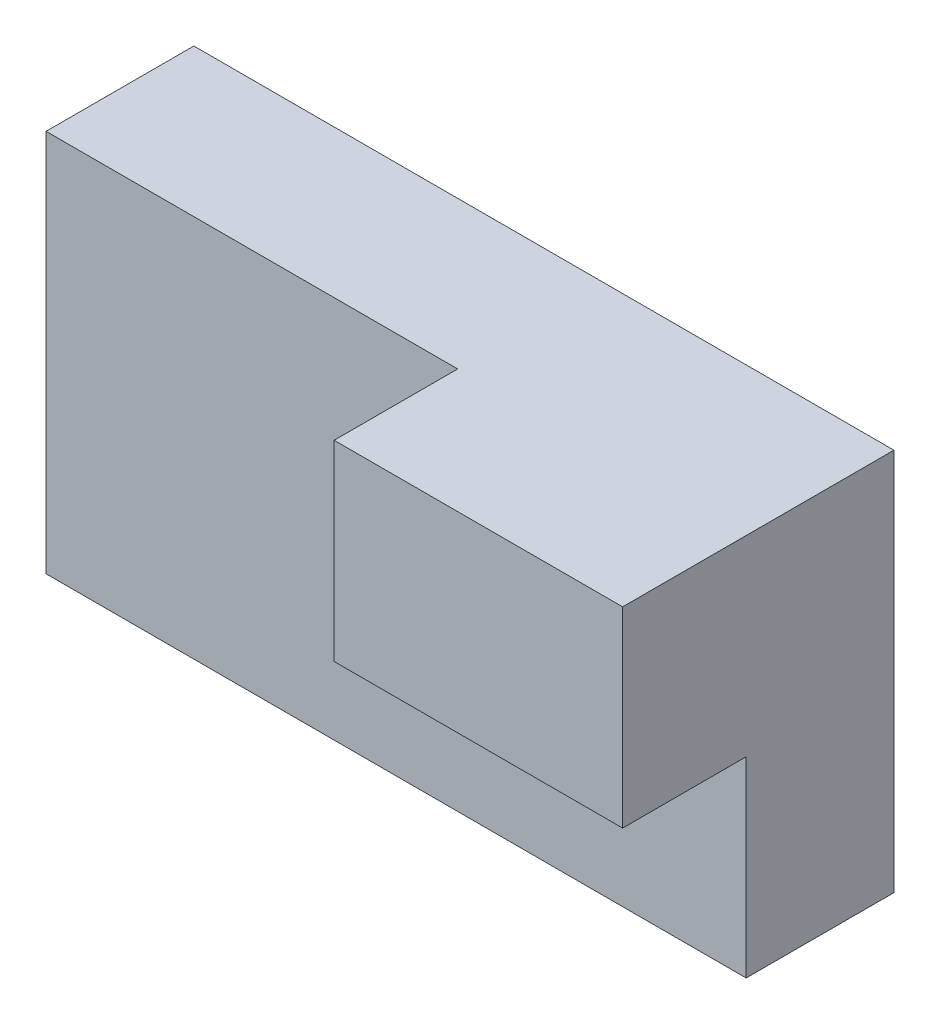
SolidWorks part; units mm, degrees
ref_plane "Front Plane" through (0, 0, 0) normal (0, 0, 1) x (1, 0, 0)
ref_plane "Top Plane" through (0, 0, 0) normal (0, 1, 0) x (1, 0, 0)
ref_plane "Right Plane" through (0, 0, 0) normal (1, 0, 0) x (0, 0, -1)
sketch "Sketch1" plane through (0, 0, 0) normal (0, 0, 1) x (1, 0, 0)
  line L0 (85.0124, -46.5334) -> (-85.0124, 46.5334) construction
  line L1 (-85.0124, 46.5334) -> (85.0124, 46.5334)
  line L2 (-85.0124, 46.5334) -> (-85.0124, -46.5334)
  line L3 (-85.0124, -46.5334) -> (85.0124, -46.5334)
  line L4 (85.0124, 46.5334) -> (85.0124, -46.5334)
extrude "Extrude1" add sketch "Sketch1" along normal blind 35.8868
ref_plane "Plane1" through (0, 0, -75) normal (0, 0, 1) x (1, 0, 0)
sketch "Sketch3" plane through (0, 0, -75) normal (0, 0, 1) x (1, 0, 0)
  line L1 (85.0124, 46.5334) -> (14.9505, 46.5334)
  line L2 (85.0124, 46.5334) -> (85.0124, 0)
  line L3 (85.0124, 0) -> (14.9505, 0)
  line L4 (14.9505, 46.5334) -> (14.9505, 0)
extrude "Boss-Extrude1" add sketch "Sketch3" along normal blind 30 from vertex at 110.8868
